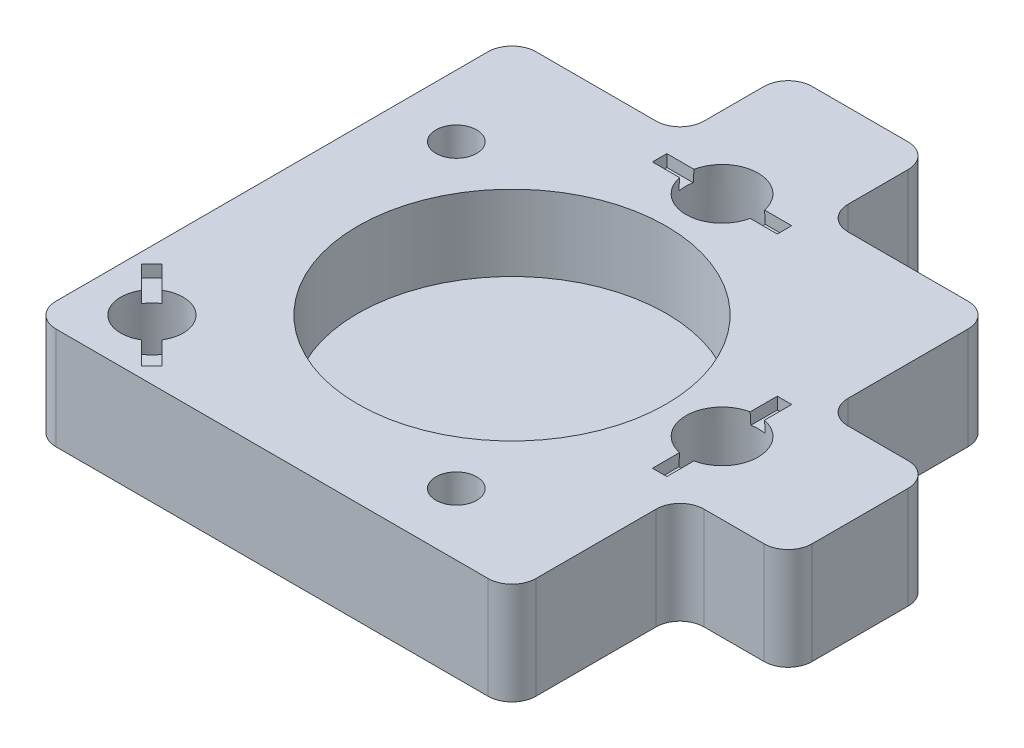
SolidWorks part; units mm, degrees
ref_plane "Front Plane" through (0, 0, 0) normal (0, 0, 1) x (1, 0, 0)
ref_plane "Top Plane" through (0, 0, 0) normal (0, 1, 0) x (1, 0, 0)
ref_plane "Right Plane" through (0, 0, 0) normal (1, 0, 0) x (0, 0, -1)
sketch "Sketch2" plane through (0, 0, 0) normal (0, 1, 0) x (1, 0, 0)
  line L0 (-20, -20) -> (20, -20)
  line L1 (20, -20) -> (20, -6)
  line L2 (20, -6) -> (29, -6)
  line L3 (29, -6) -> (29, 6)
  line L4 (29, 6) -> (20, 6)
  line L5 (20, 6) -> (20, 20)
  line L6 (20, 20) -> (6, 20)
  line L7 (6, 20) -> (6, 29)
  line L8 (6, 29) -> (-6, 29)
  line L9 (-6, 29) -> (-6, 20)
  line L10 (-6, 20) -> (-20, 20)
  line L11 (-20, 20) -> (-20, -20)
  line L16 (0, 29) -> (0, 26.6278) construction
  line L17 (26.6278, 0) -> (29, 0) construction
  line L18 (0, 0) -> (26.6278, 0) construction
  line L19 (0, 0) -> (0, 26.6278) construction
  line L20 (0, 0) -> (-20, 0) construction
  line L21 (0, 0) -> (0, -20) construction
  line L22 (0, 17.5) -> (0, 0) construction
  line L23 (0, 0) -> (17.5, 0) construction
  line L24 (-15, -15) -> (0, -15) construction
  line L25 (-15, -15) -> (-15, 0) construction
  line L30 (-15, -15) -> (-15, -20) construction
  line L31 (-15, -15) -> (-20, -15) construction
  line L32 (0, 0) -> (-15, -15) construction
  line L33 (-14.8341, 10.1955) -> (10.1955, -14.8341) construction
  circle A2 centre (17.5, 0) radius 3
  circle A3 centre (0, 17.5) radius 3
  circle A4 centre (-15, -15) radius 2.6
  circle A5 centre (-14.8341, 10.1955) radius 1.7
  circle A7 centre (0, 0) radius 18 construction
  circle A8 centre (10.1955, -14.8341) radius 1.7
  point P12 (0, 29)
  point P14 (-19.5228, -20)
  point P16 (0, 0)
  point P17 (29, 0)
  point P20 (26.6278, 0)
  point P22 (-10.3556, -19.5475)
  point P37 (0, 0)
  dimension "D3" = 3.28
  dimension "D7" = 6
  dimension "D11" = 5.2
  dimension "D9" = 36
  dimension "D13" = 3.4
  dimension "D1" = 20
  dimension "D2" = 17.5
  dimension "D4" = 29
  dimension "D6" = 6
  dimension "D8" = 5
  dimension "D10" = 15
extrude "Boss-Extrude1" add sketch "Sketch2" along normal blind 8.5
sketch "Sketch3" plane through (0, 8.5, 0) normal (0, 1, 0) x (1, 0, 0)
  circle A0 centre (0, 0) radius 12.85
  dimension "D1" = 25.7
extrude "Cut-Extrude1" cut sketch "Sketch3" against normal blind 6.3
fillet "Fillet1" radius 2 12 edges at (20, 4.25, 20) (-20, 4.25, -20) (-6, 4.25, -20) (-6, 4.25, -29) (6, 4.25, -29) (6, 4.25, -20) (20, 4.25, -20) (20, 4.25, -6) (29, 4.25, -6) (29, 4.25, 6) (20, 4.25, 6) (-20, 4.25, 20)
ref_plane "Plane2" through (0, 0, 0) normal (0, 0, 1) x (1, 0, 0)
sketch "Sketch15" plane through (0, 0, 0) normal (0, 0, 1) x (1, 0, 0)
  line L0 (0, 0) -> (0, -1.5) construction
  line L1 (0, 0) -> (0, 1.2)
  line L2 (-18, 0) -> (18, 0) construction
  line L3 (2.245, 0) -> (0, 0)
  arc A0 (0, 1.2) -> (2.245, 0) centre (0, -1.5) cw
  dimension "D2" = 2.7
  dimension "D1" = 1.5
revolve "Cut-Revolve1" cut sketch "Sketch15" angle 360 about L1
sketch "Sketch14" plane through (0, 8.5, 0) normal (0, 1, 0) x (1, 0, 0)
  line L0 (16.9, 5.2) -> (18.1, 5.2)
  line L1 (18.1, 5.2) -> (18.1, -5.2)
  line L2 (18.1, -5.2) -> (16.9, -5.2)
  line L3 (16.9, -5.2) -> (16.9, 5.2)
  line L4 (-5.2, 18.1) -> (5.2, 18.1)
  line L5 (5.2, 18.1) -> (5.2, 16.9)
  line L6 (5.2, 16.9) -> (-5.2, 16.9)
  line L7 (-5.2, 16.9) -> (-5.2, 18.1)
  line L8 (-18.2527, -10.8988) -> (-10.8988, -18.2527)
  line L9 (-10.8988, -18.2527) -> (-11.7473, -19.1012)
  line L10 (-11.7473, -19.1012) -> (-19.1012, -11.7473)
  line L11 (-19.1012, -11.7473) -> (-18.2527, -10.8988)
  line L12 (-15, -15) -> (-15.4243, -15.4243) construction
  line L13 (-15, -15) -> (-14.5757, -14.5757) construction
  line L14 (-15, -15) -> (-18.677, -11.323) construction
  line L15 (-15, -15) -> (-11.323, -18.677) construction
  line L16 (-20, 18) -> (-20, -18) construction
  point P0 (17.5, 0)
  point P1 (0, 17.5)
  point P2 (-15, -15)
  point P5 (17.5, 5.2)
  point P11 (17.5, -5.2)
  point P12 (18.1, 0)
  point P13 (16.9, 0)
  point P18 (0, 18.1)
  point P19 (0, 16.9)
  point P20 (5.2, 17.5)
  point P21 (-5.2, 17.5)
  dimension "D3" = 10.4
  dimension "D4" = 1.2
  dimension "D7" = 135
extrude "Cut-Extrude2" cut sketch "Sketch14" against normal blind 1
sketch "Sketch16" plane through (0, 0, 0) normal (0, -1, 0) x (1, 0, 0)
  line L1 (-11.8341, -8.4635) -> (-14.8341, -6.7314)
  line L2 (-14.8341, -6.7314) -> (-17.8341, -8.4635)
  line L3 (-17.8341, -8.4635) -> (-17.8341, -11.9276)
  line L4 (-17.8341, -11.9276) -> (-14.8341, -13.6596)
  line L5 (-14.8341, -13.6596) -> (-11.8341, -11.9276)
  line L6 (-11.8341, -11.9276) -> (-11.8341, -8.4635)
  line L7 (8.4635, 17.8341) -> (6.7314, 14.8341)
  line L8 (6.7314, 14.8341) -> (8.4635, 11.8341)
  line L9 (8.4635, 11.8341) -> (11.9276, 11.8341)
  line L10 (11.9276, 11.8341) -> (13.6596, 14.8341)
  line L11 (13.6596, 14.8341) -> (11.9276, 17.8341)
  line L12 (11.9276, 17.8341) -> (8.4635, 17.8341)
  line L14 (-20, -18) -> (-20, 18) construction
  line L15 (-18, 20) -> (18, 20) construction
  circle A0 centre (-14.8341, -10.1955) radius 3 construction
  circle A1 centre (10.1955, 14.8341) radius 3 construction
  dimension "D1" = 6
extrude "Cut-Extrude3" cut sketch "Sketch16" against normal blind 4.1
chamfer "Chamfer1" distance 8.5 distance2 0.5 3 edges at (0, 0, -14.5) (-15, 0, 17.6) (17.5, 0, 3)
sketch "Sketch17" plane through (0, 0, 0) normal (0, -1, 0) x (1, 0, 0)
  line L0 (-0.6, -21.5) -> (0.6, -21.5)
  line L1 (0.6, -21.5) -> (0.6, -28.5)
  line L2 (0.6, -28.5) -> (-0.6, -28.5)
  line L3 (-0.6, -28.5) -> (-0.6, -21.5)
  line L4 (21.5, 0.6) -> (28.5, 0.6)
  line L5 (28.5, 0.6) -> (28.5, -0.6)
  line L6 (28.5, -0.6) -> (21.5, -0.6)
  line L7 (21.5, -0.6) -> (21.5, 0.6)
  line L8 (28.5, 0) -> (29, 0) construction
  line L9 (29, 4) -> (29, -4) construction
  line L10 (0, -28.5) -> (0, -29) construction
  line L11 (4, -29) -> (-4, -29) construction
  point P6 (21.5, 0)
  point P9 (0, -21.5)
  dimension "D1" = 0.5
  dimension "D2" = 7
  dimension "D3" = 1.2
extrude "Cut-Extrude4" cut sketch "Sketch17" against normal blind 0.4
fillet "Fillet2" radius 0.2 8 edges at (-0.6, 0, -25) (-0.6, 0.4, -25) (0.6, 0, -25) (0.6, 0.4, -25) (25, 0, -0.6) (25, 0.4, -0.6) (25, 0, 0.6) (25, 0.4, 0.6)
